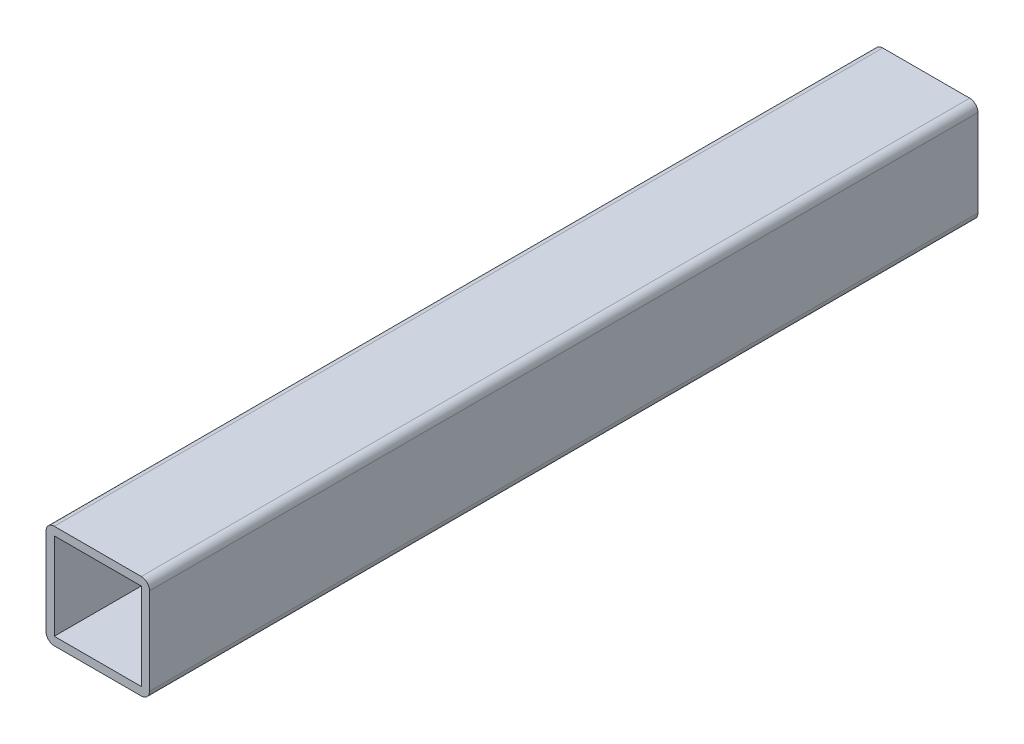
SolidWorks part; units mm, degrees
ref_plane "Спереди" through (0, 0, 0) normal (0, 0, 1) x (1, 0, 0)
ref_plane "Сверху" through (0, 0, 0) normal (0, 1, 0) x (1, 0, 0)
ref_plane "Справа" through (0, 0, 0) normal (1, 0, 0) x (0, 0, -1)
sketch "Эскиз1" plane through (0, 0, 0) normal (0, 0, 1) x (1, 0, 0)
  line L0 (-2, -2) -> (-23, -2)
  line L1 (-2, 0) -> (-23, 0)
  line L2 (0, -2) -> (0, -23)
  line L3 (-2, -25) -> (-23, -25)
  line L4 (-25, -2) -> (-25, -23)
  line L5 (-23, -2) -> (-23, -23)
  line L6 (-2, -23) -> (-23, -23)
  line L7 (-2, -2) -> (-2, -23)
  arc A0 (-23, 0) -> (-25, -2) centre (-23, -2) ccw
  arc A1 (0, -23) -> (-2, -25) centre (-2, -23) cw
  arc A2 (-23, -25) -> (-25, -23) centre (-23, -23) cw
  arc A3 (-2, 0) -> (0, -2) centre (-2, -2) cw
  arc A4 (-23, -2) -> (-23, -2) centre (-23, -2) ccw
  arc A5 (-23, -23) -> (-23, -23) centre (-23, -23) cw
  arc A6 (-2, -23) -> (-2, -23) centre (-2, -23) cw
  arc A7 (-2, -2) -> (-2, -2) centre (-2, -2) cw
  point P7 (-25, 0)
  point P12 (-25, -25)
  point P15 (0, 0)
  dimension "D3" = 2
  dimension "D1" = 25
  dimension "D2" = 25
  dimension "D4" = 2
extrude "Бобышка-Вытянуть1" add sketch "Эскиз1" along normal blind 200
